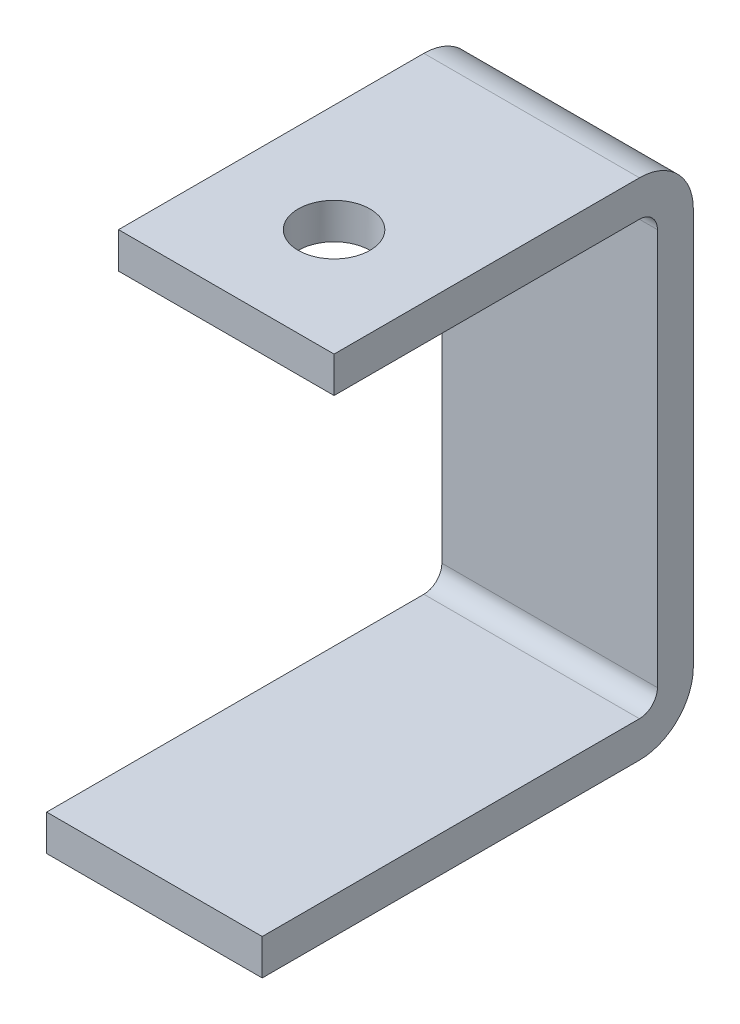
SolidWorks part; units mm, degrees
ref_plane "front" through (0, 0, 0) normal (0, 0, 1) x (1, 0, 0)
ref_plane "top" through (0, 0, 0) normal (0, 1, 0) x (1, 0, 0)
ref_plane "right" through (0, 0, 0) normal (1, 0, 0) x (0, 0, -1)
sketch "Sketch1" plane through (0, 0, 0) normal (1, 0, 0) x (0, 0, -1)
  line L0 (0, 0) -> (0, 76.454)
  line L1 (0, 76.454) -> (-57.15, 76.454)
  line L4 (-69.85, 0) -> (-44.45, 0)
  line L5 (-44.45, 0) -> (0, 0)
  dimension "D1" = 76.454
  dimension "D2" = 57.15
  dimension "D3" = 0
  dimension "D4" = 25.4
  dimension "D5" = 44.45
extrude "Base-Extrude-Thin" add sketch "Sketch1" along normal mid plane 38.1 thin
sketch "Sketch2" plane through (0, 82.804, 0) normal (0, 1, 0) x (-1, 0, 0)
  line L0 (0, 50) -> (0, -50) construction
  line L1 (-19.05, 57.15) -> (19.05, 57.15) construction
  circle A0 centre (0, 38.1) radius 6.35
  dimension "D1" = 12.7
  dimension "D2" = 19.05
extrude "Cut-Extrude1" cut sketch "Sketch2" against normal up to next
